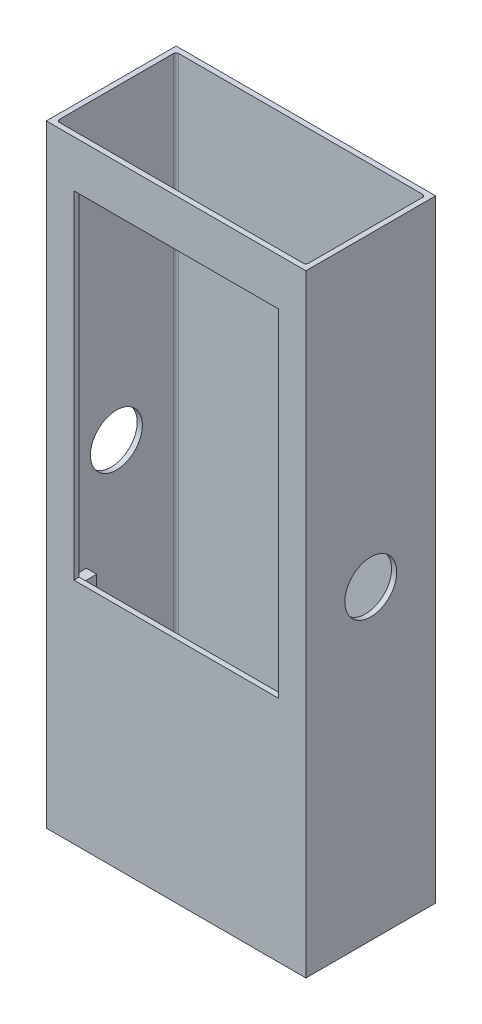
SolidWorks part; units mm, degrees
ref_plane "Front Plane" through (0, 0, 0) normal (0, 0, 1) x (1, 0, 0)
ref_plane "Top Plane" through (0, 0, 0) normal (0, 1, 0) x (1, 0, 0)
ref_plane "Right Plane" through (0, 0, 0) normal (1, 0, 0) x (0, 0, -1)
sketch "Sketch1" plane through (0, 0, 0) normal (0, 1, 0) x (1, 0, 0)
  line L1 (0, 0) -> (127, 0)
  line L2 (0, 0) -> (0, 63.5)
  line L3 (0, 63.5) -> (127, 63.5)
  line L4 (127, 0) -> (127, 63.5)
extrude "Boss-Extrude1" add sketch "Sketch1" against normal blind 302.26
sketch "Sketch2" plane through (0, -302.26, 0) normal (0, -1, 0) x (1, 0, 0)
  line L0 (0, -63.5) -> (0, -60.96)
  line L1 (0, -63.5) -> (0, 0) construction
  line L2 (0, -60.96) -> (2.54, -60.96)
  line L3 (127, 0) -> (127, -2.54)
  line L4 (127, 0) -> (127, -63.5) construction
  line L5 (127, -2.54) -> (124.46, -2.54)
  line L7 (2.54, -60.96) -> (124.46, -60.96)
  line L8 (2.54, -60.96) -> (2.54, -2.54)
  line L9 (2.54, -2.54) -> (124.46, -2.54)
  line L10 (124.46, -60.96) -> (124.46, -2.54)
extrude "Cut-Extrude1" cut sketch "Sketch2" against normal blind 299.72 contours L7 L10 L9 L8
fillet "Fillet3" radius 1.27 1 edges at (2.54, -152.4, -60.96)
fillet "Fillet4" radius 1.27 1 edges at (2.54, -152.4, -2.54)
fillet "Fillet5" radius 1.27 1 edges at (124.46, -152.4, -2.54)
fillet "Fillet6" radius 1.27 1 edges at (124.46, -152.4, -60.96)
sketch "Sketch3" plane through (0, 0, 0) normal (-1, 0, 0) x (0, 0, 1)
  line L0 (-63.5, -302.26) -> (-31.75, -302.26)
  line L1 (-63.5, -302.26) -> (0, -302.26) construction
  line L2 (-31.75, -302.26) -> (-31.75, -152.4)
  circle A0 centre (-31.75, -152.4) radius 12.7
extrude "Cut-Extrude3" cut sketch "Sketch3" against normal blind 254
sketch "Sketch4" plane through (0, 0, 0) normal (0, 1, 0) x (1, 0, 0)
  line L1 (0, 0) -> (127, 0)
  line L2 (0, 0) -> (0, 63.5)
  line L3 (0, 63.5) -> (127, 63.5)
  line L4 (127, 0) -> (127, 63.5)
extrude "Cut-Extrude4" cut sketch "Sketch4" against normal blind 2.54
sketch "Sketch5" plane through (0, 0, 0) normal (0, 0, 1) x (1, 0, 0)
  line L0 (0, -2.54) -> (13.5, -2.54)
  line L1 (0, -2.54) -> (127, -2.54) construction
  line L2 (13.5, -2.54) -> (13.5, -25.4)
  line L3 (127, -2.54) -> (113.5, -2.54)
  line L4 (113.5, -2.54) -> (113.5, -25.4)
  line L5 (13.5, -25.4) -> (113.5, -25.4)
  line L6 (13.5, -25.4) -> (13.5, -190.4)
  line L7 (113.5, -25.4) -> (113.5, -190.4)
  line L8 (113.5, -190.4) -> (13.5, -190.4)
extrude "Cut-Extrude5" cut sketch "Sketch5" against normal blind 25.4 and the other way blind 8.128 contours L8 L7 L5 L6
sketch "Sketch6" plane through (0, 0, -2.54) normal (0, 0, -1) x (-1, 0, 0)
  line L3 (-11.576, -17.86) -> (-9.036, -17.86)
  line L4 (-9.036, -17.86) -> (-9.036, -22.94)
  line L6 (-9.036, -22.94) -> (-14.116, -22.94)
  line L8 (-14.116, -22.94) -> (-14.116, -17.86)
  line L9 (-14.116, -17.86) -> (-11.576, -17.86)
  circle A0 centre (-11.576, -20.4) radius 1.6
extrude "Boss-Extrude3" add sketch "Sketch6" along normal blind 8 contours L3 L4 L6 L8 L9 | A0
sketch "Sketch8" plane through (0, 0, -2.54) normal (0, 0, -1) x (-1, 0, 0)
  line L0 (-113.5, -25.4) -> (-112.884, -25.4)
  line L1 (-13.5, -25.4) -> (-113.5, -25.4) construction
  line L2 (-112.884, -25.4) -> (-112.884, -22.94)
  line L3 (-112.884, -17.86) -> (-117.964, -22.94)
  line L4 (-112.884, -22.94) -> (-117.964, -22.94)
  line L5 (-112.884, -22.94) -> (-112.884, -17.86)
  line L6 (-112.884, -17.86) -> (-117.964, -17.86)
  line L7 (-117.964, -22.94) -> (-117.964, -17.86)
  line L8 (-117.964, -17.86) -> (-112.884, -22.94)
  circle A0 centre (-115.424, -20.4) radius 1.6
extrude "Boss-Extrude4" add sketch "Sketch8" along normal blind 8 contours A0 L8 L7 L3 | A0 L3 L6 L8 | A0 L8 L5 L3 | A0 L3 L4 L8
sketch "Sketch10" plane through (0, 0, -2.54) normal (0, 0, -1) x (-1, 0, 0)
  line L0 (-113.5, -190.4) -> (-112.884, -190.4)
  line L1 (-113.5, -190.4) -> (-13.5, -190.4) construction
  line L2 (-112.884, -190.4) -> (-112.884, -192.86)
  line L3 (-117.964, -192.86) -> (-112.884, -197.94)
  line L4 (-112.884, -192.86) -> (-117.964, -192.86)
  line L5 (-112.884, -192.86) -> (-112.884, -197.94)
  line L6 (-112.884, -197.94) -> (-117.964, -197.94)
  line L7 (-117.964, -192.86) -> (-117.964, -197.94)
  line L8 (-112.884, -192.86) -> (-117.964, -197.94)
  circle A0 centre (-115.424, -195.4) radius 1.6
extrude "Boss-Extrude5" add sketch "Sketch10" along normal blind 8 contours A0 L3 L7 L8 | A0 L8 L4 L3 | A0 L3 L5 L8 | A0 L8 L6 L3
sketch "Sketch11" plane through (0, 0, -2.54) normal (0, 0, -1) x (-1, 0, 0)
  line L0 (-13.5, -190.4) -> (-14.116, -190.4)
  line L1 (-113.5, -190.4) -> (-13.5, -190.4) construction
  line L2 (-14.116, -190.4) -> (-14.116, -192.86)
  line L3 (-14.116, -192.86) -> (-9.036, -197.94)
  line L4 (-14.116, -192.86) -> (-9.036, -192.86)
  line L5 (-14.116, -192.86) -> (-14.116, -197.94)
  line L6 (-14.116, -197.94) -> (-9.036, -197.94)
  line L7 (-9.036, -192.86) -> (-9.036, -197.94)
  line L8 (-14.116, -197.94) -> (-9.036, -192.86)
  circle A0 centre (-11.576, -195.4) radius 1.6
extrude "Boss-Extrude6" add sketch "Sketch11" along normal blind 8 contours A0 L3 L5 L8 | A0 L8 L4 L3 | A0 L3 L7 L8 | A0 L8 L6 L3
